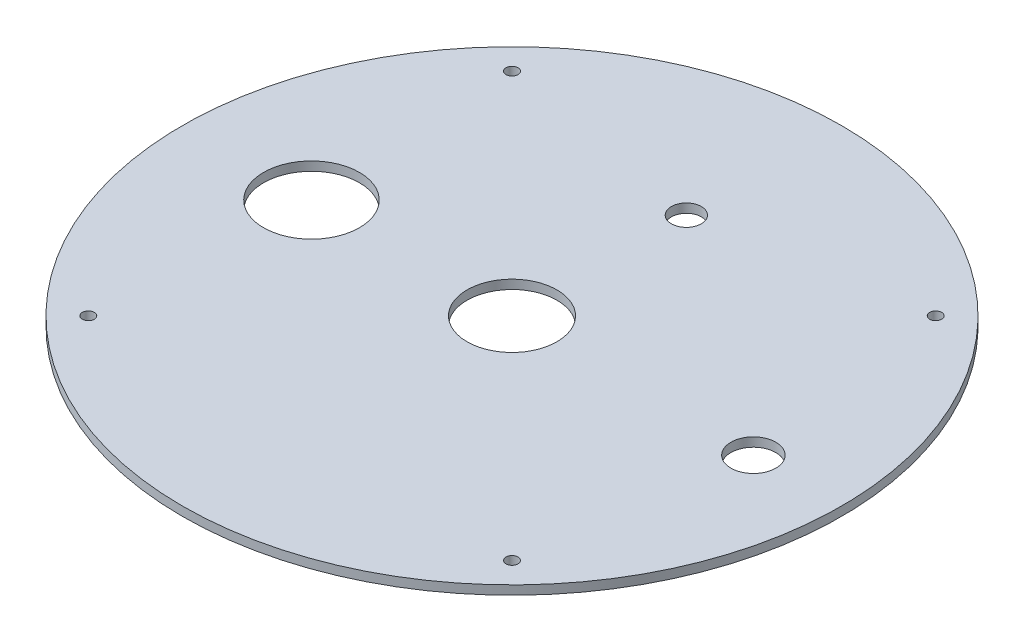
SolidWorks part; units mm, degrees
ref_plane "Front Plane" through (0, 0, 0) normal (0, 0, 1) x (1, 0, 0)
ref_plane "Top Plane" through (0, 0, 0) normal (0, 1, 0) x (1, 0, 0)
ref_plane "Right Plane" through (0, 0, 0) normal (1, 0, 0) x (0, 0, -1)
sketch "Sketch1" plane through (0, 0, 0) normal (0, 1, 0) x (1, 0, 0)
  circle A0 centre (0, 0) radius 55
  dimension "D1" = 110
extrude "Boss-Extrude1" add sketch "Sketch1" along normal blind 1.5
sketch "Sketch2" plane through (0, 1.5, 0) normal (0, 1, 0) x (1, 0, 0)
  line L0 (-35.3553, 35.3553) -> (35.3553, -35.3553) construction
  line L1 (-35.3553, -35.3553) -> (35.3553, 35.3553) construction
  line L2 (0, -0.825) -> (0, 0.825) construction
  circle A0 centre (-35.3553, 35.3553) radius 1
  circle A1 centre (-35.3553, -35.3553) radius 1
  circle A2 centre (35.3553, -35.3553) radius 1
  circle A3 centre (35.3553, 35.3553) radius 1
  circle A4 centre (0, 0) radius 7.5
  dimension "D3" = 2
  dimension "D4" = 15
  dimension "D1" = 100
  dimension "D2" = 45
extrude "Cut-Extrude1" cut sketch "Sketch2" against normal up to surface (1.5 mm away)
sketch "Sketch4" plane through (0, 0, 0) normal (0, -1, 0) x (1, 0, 0)
  line L0 (0, -29.5929) -> (0, -29.0955) construction
  circle A0 centre (0, 0) radius 10.6733
  circle A1 centre (-33.4623, 0) radius 22.789
  circle A2 centre (-39.8086, 0) radius 19.9043
  circle A3 centre (0, 0) radius 19.9043
  circle A4 centre (0, 0) radius 14.1747
  circle A5 centre (0, 0) radius 14.9208
  circle A6 centre (0, -29.5929) radius 14.6721
  circle A7 centre (0, -29.0955) radius 14.9208
  circle A8 centre (0, 0) radius 18.8996
  circle A9 centre (0, 0) radius 21.3864
  circle A10 centre (42.7729, 0) radius 21.3864
  circle A11 centre (40.2861, 0) radius 21.3864
  dimension "D1" = 21.3467
  dimension "D2" = 45.578
  dimension "D3" = 39.8086
  dimension "D4" = 39.8086
  dimension "D6" = 28.3495
  dimension "D7" = 29.3442
  dimension "D8" = 29.8416
  dimension "D9" = 29.8416
  dimension "D11" = 37.7993
  dimension "D12" = 42.7729
  dimension "D13" = 42.7729
  dimension "D14" = 42.7729
  dimension "D5" = 6.3463
  dimension "D10" = 0.4974
  dimension "D15" = 2.4868
sketch "Sketch5" plane through (0, 0, 0) normal (0, -1, 0) x (1, 0, 0)
  circle A0 centre (-33.4623, 0) radius 8
  circle A1 centre (0, -29.0955) radius 2.5
  circle A2 centre (40.2861, 0) radius 3.75
  dimension "D1" = 16
  dimension "D2" = 5
  dimension "D3" = 7.5
extrude "Cut-Extrude4" cut sketch "Sketch5" against normal blind 1.5
equation "\"scale\"= 1.5625"
equation "\"mars1\"= 37"
equation "\"mars2\"= 79"
equation "\"mars3\"= 69"
equation "\"mars4\"= 69"
equation "\"jupiter1\"= 76"
equation "\"jupiter2\"= 83"
equation "\"jupiter3\"= 86"
equation "\"jupiter4\"= 86"
equation "\"saturn1\"= 57"
equation "\"saturn2\"= 59"
equation "\"saturn3\"= 60"
equation "\"saturn4\"= 60"
equation "\"D1@Sketch4\"  = \"mars1\" / pi * \"scale\" * .58 / .5"
equation "\"D2@Sketch4\"  = \"mars2\" / pi * \"scale\" * .58 / .5"
equation "\"D3@Sketch4\"  = \"mars3\" / pi * \"scale\" * .58 / .5"
equation "\"D4@Sketch4\"  = \"mars4\" / pi * \"scale\" * .58 / .5"
equation "\"D6@Sketch4\" = \"saturn1\" / pi * \"scale\""
equation "\"D7@Sketch4\"=\"saturn2\"/pi*\"scale\""
equation "\"D8@Sketch4\"=\"saturn3\"/pi*\"scale\""
equation "\"D9@Sketch4\"=\"saturn4\"/pi*\"scale\""
equation "\"D11@Sketch4\"=\"jupiter1\"/pi*\"scale\""
equation "\"D12@Sketch4\"=\"jupiter3\"/pi*\"scale\""
equation "\"D13@Sketch4\"=\"jupiter4\"/pi*\"scale\""
equation "\"D14@Sketch4\"=\"jupiter4\"/pi*\"scale\""
